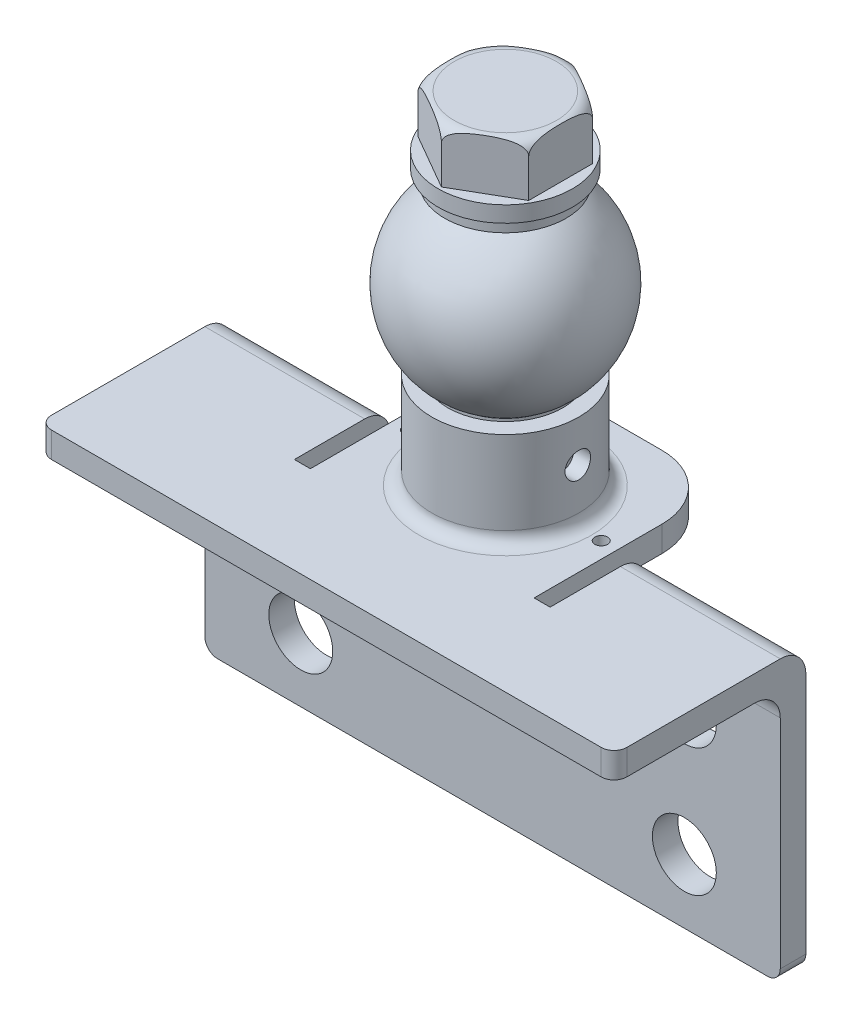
SolidWorks part; units mm, degrees
ref_plane "Front Plane" through (0, 0, 0) normal (0, 0, 1) x (1, 0, 0)
ref_plane "Top Plane" through (0, 0, 0) normal (0, 1, 0) x (1, 0, 0)
ref_plane "Right Plane" through (0, 0, 0) normal (1, 0, 0) x (0, 0, -1)
sketch "Sketch1" plane through (0, 0, 0) normal (1, 0, 0) x (0, 0, -1)
  line L0 (-27.0435, 0) -> (27.0435, 0) construction
  line L1 (-2, 0) -> (-2, 36)
  line L3 (2, 40) -> (2, 0)
  line L4 (-2, 0) -> (2, 0)
  line L5 (-2, 44) -> (-28, 44)
  line L6 (-28, 44) -> (-28, 40)
  line L7 (-28, 40) -> (-6, 40)
  arc A0 (-2, 36) -> (-6, 40) centre (-6, 36) ccw
  arc A1 (-2, 44) -> (2, 40) centre (-2, 40) cw
  point P3 (0, 0)
  point P14 (2, 44)
  dimension "D1" = 4
  dimension "D2" = 44
  dimension "D3" = 30
  dimension "D4" = 4
  dimension "D5" = 4
extrude "Boss-Extrude1" add sketch "Sketch1" along normal mid plane 90 contours L7 A0 L1 L4 L3 A1 L5 L6
sketch "Sketch2" plane through (0, 0, -2) normal (0, 0, -1) x (-1, 0, 0)
  line L0 (0, 0) -> (0, 40) construction
  line L1 (-45, 40) -> (45, 40) construction
  line L3 (-30, 30) -> (30, 30) construction
  line L4 (-30, 30) -> (-30, 10) construction
  line L5 (-30, 10) -> (30, 10) construction
  line L6 (30, 30) -> (30, 10) construction
  line L7 (-30, 30) -> (30, 10) construction
  line L8 (-30, 10) -> (30, 30) construction
  circle A0 centre (-30, 30) radius 5
  circle A1 centre (-30, 10) radius 5
  circle A2 centre (30, 10) radius 5
  circle A3 centre (30, 30) radius 5
  point P5 (0, 20)
  dimension "D3" = 10
  dimension "D1" = 60
  dimension "D2" = 20
extrude "Cut-Extrude1" cut sketch "Sketch2" against normal blind 40 contours A1
sketch "Sketch3" plane through (0, 44, 0) normal (0, 1, 0) x (1, 0, 0)
  line L0 (45, 2) -> (-45, 2) construction
  line L1 (-20, 13) -> (20, 13)
  line L2 (-20, 13) -> (-20, -13)
  line L3 (-20, -13) -> (20, -13)
  line L4 (20, 13) -> (20, -13)
  line L5 (-20, 13) -> (20, -13) construction
  line L6 (-20, -13) -> (20, 13) construction
  point P0 (0, 0)
  dimension "D1" = 40
  dimension "D2" = 15
extrude "Cut-Extrude2" cut sketch "Sketch3" against normal blind 23
sketch "Sketch4" plane through (0, 0, 13) normal (0, 0, -1) x (-1, 0, 0)
  line L0 (-20, 42) -> (20, 42) construction
  line L1 (-20, 40) -> (-20, 44) construction
  line L2 (20, 40) -> (20, 44) construction
  line L3 (20, 40) -> (-20, 40) construction
  line L4 (-17.5, 44) -> (17.5, 44)
  line L5 (-17.5, 44) -> (-17.5, 40)
  line L6 (-17.5, 40) -> (17.5, 40)
  line L7 (17.5, 44) -> (17.5, 40)
  line L8 (-17.5, 44) -> (17.5, 40) construction
  line L9 (-17.5, 40) -> (17.5, 44) construction
  point P6 (0, 42)
  dimension "D1" = 35
extrude "Boss-Extrude2" add sketch "Sketch4" along normal blind 30
fillet "Fillet1" radius 10 2 edges at (17.5, 42, -17) (-17.5, 42, -17)
sketch "Sketch5" plane through (0, 44, 0) normal (0, 1, 0) x (1, 0, 0)
  line L0 (-15, 0) -> (15, 0) construction
  line L1 (0, 0) -> (0, -18.8965) construction
  circle A0 centre (0, 0) radius 9
  circle A1 centre (-15, 0) radius 1
  circle A2 centre (15, 0) radius 1
  point P6 (0, 0)
  dimension "D1" = 18
  dimension "D2" = 2
  dimension "D3" = 30
extrude "Cut-Extrude3" cut sketch "Sketch5" against normal blind 10
sketch "Sketch6" plane through (0, 44, 0) normal (0, 1, 0) x (1, 0, 0)
  circle A0 centre (0, 0) radius 11.5
  circle A1 centre (0, 0) radius 9 construction
  circle A2 centre (0, 0) radius 9
  dimension "D1" = 23
extrude "Boss-Extrude3" add sketch "Sketch6" along normal blind 15
fillet "Fillet2" radius 2 1 edges at (0, 44, -11.5)
fillet "Fillet3" radius 2 4 edges at (-45, 0, 0) (45, 0, 0) (-45, 42, 28) (45, 42, 28)
sketch "Sketch7" plane through (0, 0, 0) normal (1, 0, 0) x (0, 0, -1)
  line L0 (0, 59) -> (0, 46) construction
  line L1 (9, 59) -> (-9, 59) construction
  line L2 (11.5, 46) -> (-11.5, 46) construction
  circle A0 centre (0, 52.5) radius 2
  dimension "D1" = 4
extrude "Cut-Extrude4" cut sketch "Sketch7" against normal mid plane 80
sketch "Sketch8" plane through (0, 0, 0) normal (1, 0, 0) x (0, 0, -1)
  line L0 (0, 35.8155) -> (0, 86.4274) construction
  line L1 (-8.4, 40) -> (-8.4, 59)
  line L2 (11.5, 59) -> (-11.5, 59) construction
  line L4 (7, 40) -> (-13, 40) construction
  line L5 (-8.4, 40) -> (0, 40)
  line L6 (0, 40) -> (0, 86.4274)
  arc A0 (-8.4, 59) -> (0, 86.4274) centre (0, 71.4274) cw
  dimension "D2" = 15
  dimension "D1" = 8.4
revolve "Revolve1" add sketch "Sketch8" angle 360 about L6
sketch "Sketch9" plane through (0, 0, 0) normal (1, 0, 0) x (0, 0, -1)
  circle A0 centre (0, 52.5) radius 2 construction
  circle A1 centre (0, 52.5) radius 2
extrude "Cut-Extrude5" cut sketch "Sketch9" against normal mid plane 56
ref_plane "Plane1" through (0, 71, 0) normal (0, 1, 0) x (1, 0, 0)
sketch "Sketch10" plane through (0, 71, 0) normal (0, 1, 0) x (1, 0, 0)
  circle A0 centre (0, 0) radius 7.5
  dimension "D1" = 15
extrude "Cut-Extrude6" cut sketch "Sketch10" along normal blind 32.5
sketch "Sketch11" plane through (0, 0, 0) normal (0, 0, 1) x (1, 0, 0)
  line L0 (-7, 71) -> (-7, 89.4178)
  line L1 (12.65, 71) -> (-12.65, 71) construction
  line L2 (-7.5, 84.4178) -> (7.5, 84.4178) construction
  line L3 (-7, 89.4178) -> (-10, 89.4178)
  line L4 (0, 84.4178) -> (0, 100.4642) construction
  line L5 (-10, 89.4178) -> (-10, 95.4178)
  line L6 (0, 84.4178) -> (0, 67.4145) construction
  line L7 (-8, 97.4178) -> (0, 97.4178)
  line L8 (-7, 71) -> (0, 71)
  line L9 (0, 71) -> (0, 97.4178)
  arc A0 (-8, 97.4178) -> (-10, 95.4178) centre (-8, 95.4178) ccw
  point P15 (-10, 97.4178)
  dimension "D5" = 2
  dimension "D1" = 7
  dimension "D2" = 5
  dimension "D3" = 10
  dimension "D4" = 8
revolve "Revolve2" add sketch "Sketch11" angle 360 about L9
sketch "Sketch12" plane through (0, 97.4178, 0) normal (0, 1, 0) x (1, 0, 0)
  line L0 (0, 0) -> (0, 10) construction
  line L1 (0, 0) -> (8.6603, 5) construction
  line L2 (0, 0) -> (8.6603, -5) construction
  line L3 (0, 0) -> (0, -10) construction
  line L4 (0, 0) -> (-8.6603, -5) construction
  line L5 (0, 0) -> (-8.6603, 5) construction
  line L6 (0, 10) -> (8.6603, 5)
  line L7 (8.6603, 5) -> (8.6603, -5)
  line L8 (8.6603, -5) -> (0, -10)
  line L9 (0, -10) -> (-8.6603, -5)
  line L10 (-8.6603, -5) -> (-8.6603, 5)
  line L11 (-8.6603, 5) -> (0, 10)
  circle A0 centre (0, 0) radius 10 construction
  point P11 (0, 0)
  dimension "D1" = 20
  dimension "D2" = 6
extrude "Cut-Extrude8" cut sketch "Sketch12" against normal blind 10.5 flip side to cut
sketch "Sketch13" plane through (0, 89.4178, 0) normal (0, -1, 0) x (1, 0, 0)
  line L0 (1.5979, -7.0717) -> (2.3141, -10.2418)
  line L1 (2.4766, -6.8139) -> (3.5868, -9.8684)
  arc A0 (3.5868, -9.8684) -> (2.3141, -10.2418) centre (0, 0) ccw
  arc A1 (2.4766, -6.8139) -> (1.5979, -7.0717) centre (0, 0) ccw
  dimension "D1" = 21
  dimension "D2" = 14.5
extrude "Boss-Extrude4" add sketch "Sketch13" along normal blind 2.5 separate body
sketch "Sketch14" plane through (0, 86.9178, 0) normal (0, -1, 0) x (1, 0, 0)
  circle A1 centre (0, 0) radius 7.25
  circle A2 centre (0, 0) radius 9.5
  dimension "D1" = 19
  dimension "D2" = 14.5
extrude "Boss-Extrude5" add sketch "Sketch14" along normal blind 2 separate body
